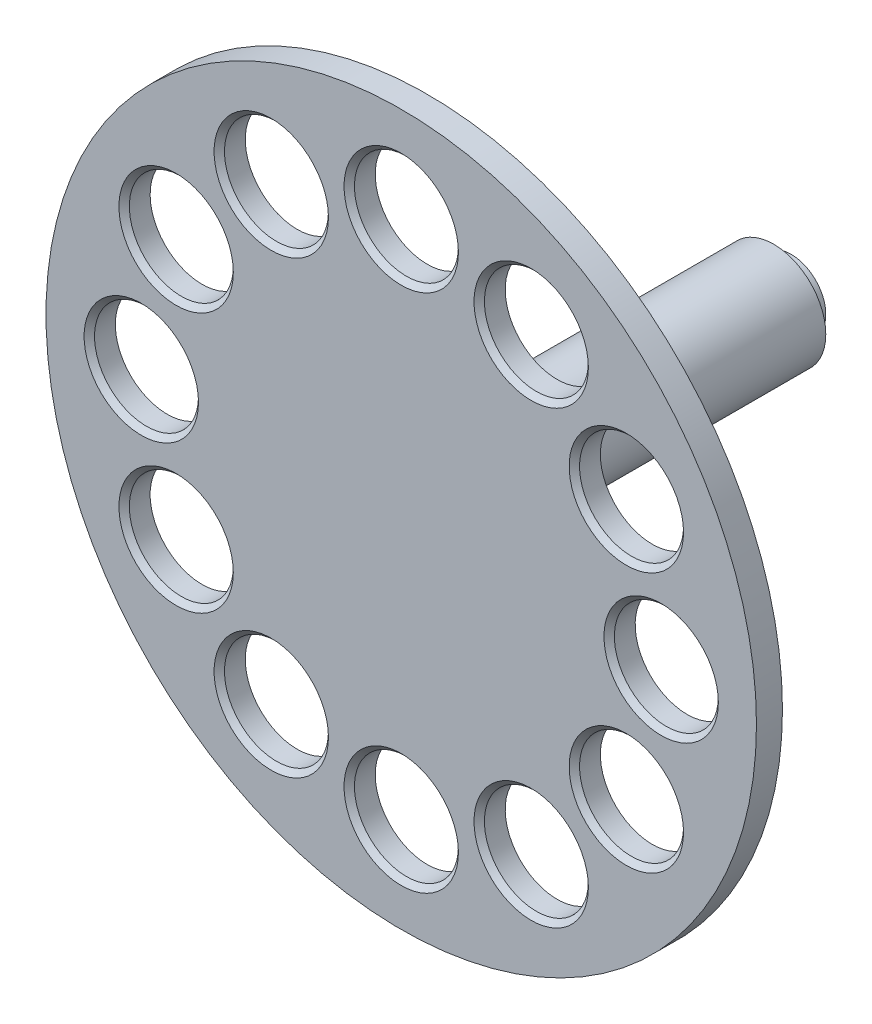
SolidWorks part; units mm, degrees
ref_plane "Face" through (0, 0, 0) normal (0, 0, 1) x (1, 0, 0)
ref_plane "Dessus" through (0, 0, 0) normal (0, 1, 0) x (1, 0, 0)
ref_plane "Droite" through (0, 0, 0) normal (1, 0, 0) x (0, 0, -1)
sketch "Esquisse1" plane through (0, 0, 0) normal (0, 0, 1) x (1, 0, 0)
  circle A0 centre (0, 0) radius 205
  dimension "D1" = 410
extrude "Base-Extrusion" add sketch "Esquisse1" along normal blind 15
sketch "Esquisse2" plane through (0, 0, 15) normal (0, 0, 1) x (1, 0, 0)
  line L0 (0, 0) -> (0, 224.5238) construction
  circle A0 centre (0, 150) radius 30
  circle A1 centre (0, 0) radius 205 construction
  dimension "D1" = 150
  dimension "D2" = 60
extrude "Enlèv. mat.-Extru.1" cut sketch "Esquisse2" against normal through all
chamfer "Chanfrein1" distance 3 angle 45
pattern_circular "Répétition circulaire1" count 12 over 360
sketch "Esquisse3" plane through (0, 0, 0) normal (0, 0, -1) x (-1, 0, 0)
  circle A0 centre (0, 0) radius 30
  circle A1 centre (0, 0) radius 205 construction
  dimension "D1" = 60
extrude "Boss.-Extru.1" add sketch "Esquisse3" along normal blind 200
sketch "Esquisse4" plane through (0, 0, -200) normal (0, 0, -1) x (-1, 0, 0)
  circle A0 centre (0, 0) radius 20
  circle A1 centre (0, 0) radius 30 construction
  dimension "D1" = 40
extrude "Boss.-Extru.2" add sketch "Esquisse4" along normal blind 10
sketch "Esquisse5" plane through (0, 0, 15) normal (0, 0, 1) x (1, 0, 0)
  line L0 (0, 0) -> (-429.0022, -429.0022) construction
  line L1 (0, 0) -> (-129.9038, -75)
  line L2 (0, 0) -> (-75, -129.9038)
  circle A0 centre (0, 0) radius 205 construction
  circle A1 centre (-129.9038, -75) radius 33 construction
  circle A2 centre (-75, -129.9038) radius 33 construction
